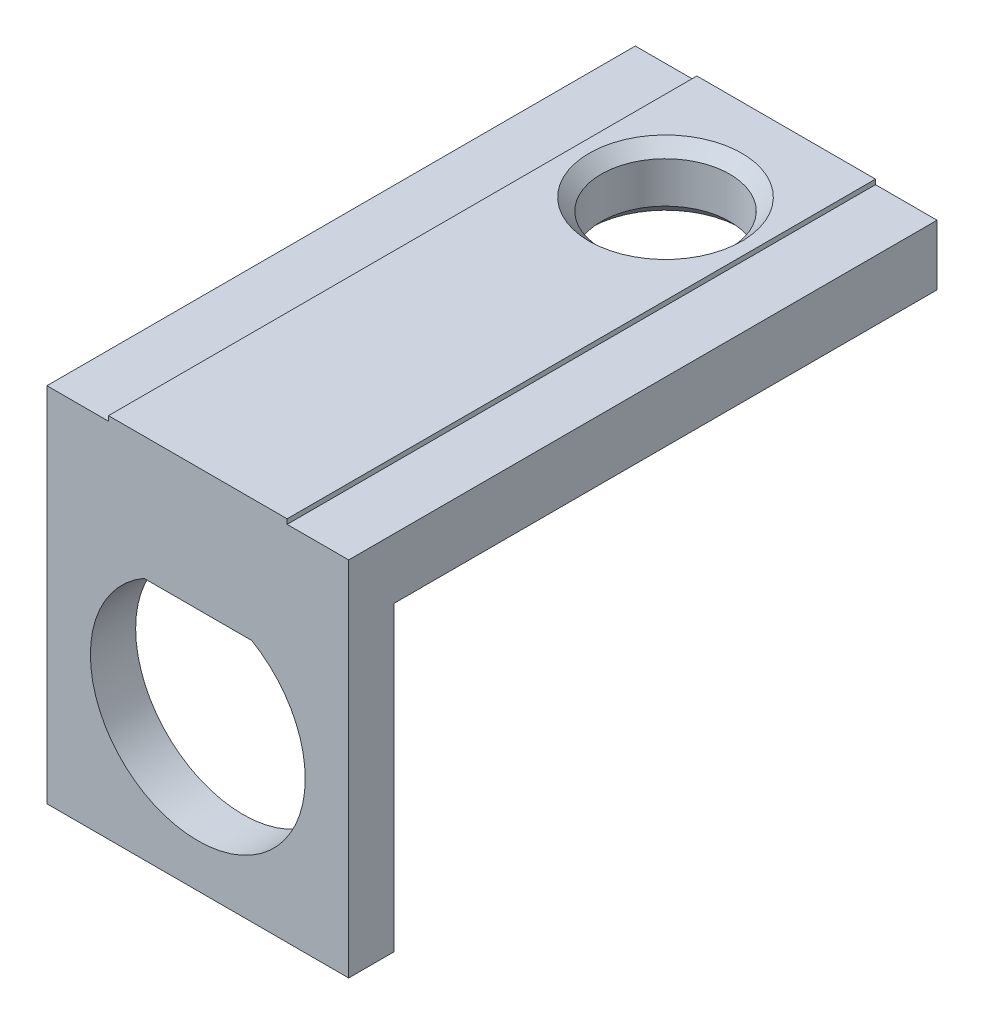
SolidWorks part; units mm, degrees
ref_plane "Front" through (0, 0, 0) normal (0, 0, 1) x (1, 0, 0)
ref_plane "Top" through (0, 0, 0) normal (0, 1, 0) x (1, 0, 0)
ref_plane "Right" through (0, 0, 0) normal (1, 0, 0) x (0, 0, -1)
sketch "Sketch1" plane through (0, 0, 0) normal (0, 0, 1) x (1, 0, 0)
  line L0 (-7.9375, -5.6515) -> (7.9375, -5.6515) construction
  line L1 (-7.9375, 11.1125) -> (7.9375, 11.1125)
  line L2 (-7.9375, 11.1125) -> (-7.9375, -11.1125)
  line L3 (-7.9375, -11.1125) -> (7.9375, -11.1125)
  line L4 (7.9375, 11.1125) -> (7.9375, -11.1125)
  line L5 (-7.9375, 11.1125) -> (7.9375, -11.1125) construction
  line L6 (-7.9375, -11.1125) -> (7.9375, 11.1125) construction
  line L7 (-7.9375, 4.8895) -> (7.9375, 4.8895) construction
  line L8 (-2.8341, 4.8895) -> (2.8341, 4.8895)
  arc A0 (-2.8341, 4.8895) -> (2.8341, 4.8895) centre (0, 0) ccw
  point P0 (0, 0)
  dimension "D3" = 11.303
  dimension "D1" = 15.875
  dimension "D2" = 22.225
  dimension "D4" = 10.541
extrude "Boss-Extrude1" add sketch "Sketch1" along normal blind 2.3813
sketch "Sketch2" plane through (0, 0, 0) normal (0, 0, -1) x (-1, 0, 0)
  line L0 (7.9375, 11.1125) -> (7.9375, -11.1125) construction
  line L1 (-7.9375, 11.1125) -> (7.9375, 11.1125)
  line L2 (-7.9375, 11.1125) -> (-7.9375, 7.9375)
  line L3 (-7.9375, 7.9375) -> (7.9375, 7.9375)
  line L4 (7.9375, 11.1125) -> (7.9375, 7.9375)
  line L5 (-11.1799, 0) -> (14.4512, 0) construction
  dimension "D1" = 3.175
extrude "Boss-Extrude2" add sketch "Sketch2" along normal blind 28.575
sketch "Sketch12" plane through (0, 0, 0) normal (0, 0, -1) x (-1, 0, 0)
  line L0 (7.9375, 7.9375) -> (7.9375, -11.1125) construction
  line L1 (-7.9375, -11.1125) -> (7.9375, -11.1125)
  line L2 (-7.9375, -11.1125) -> (-7.9375, -7.9375)
  line L3 (-7.9375, -7.9375) -> (7.9375, -7.9375)
  line L4 (7.9375, -11.1125) -> (7.9375, -7.9375)
  dimension "D1" = 3.175
extrude "Cut-Extrude1" cut sketch "Sketch12" against normal through all
sketch "Sketch15" plane through (0, 11.1125, 0) normal (0, 1, 0) x (1, 0, 0)
  line L0 (-7.9375, 28.575) -> (7.9375, 28.575) construction
  line L1 (-4.699, 28.575) -> (4.699, 28.575)
  line L2 (-4.699, 28.575) -> (-4.699, -2.3813)
  line L3 (-4.699, -2.3813) -> (4.699, -2.3813)
  line L4 (4.699, 28.575) -> (4.699, -2.3813)
  line L5 (7.9375, -2.3813) -> (-7.9375, -2.3813) construction
  dimension "D1" = 9.398
  dimension "D2" = 4.699
extrude "Boss-Extrude7" add sketch "Sketch15" along normal blind 0.254
hole_wizard "1/4-20 Tapped Hole2" positions "Sketch14" profile "Sketch13" tap size "1/4-20" standard "Ansi Inch"
sketch "Sketch14" plane through (0.0517, 11.3665, -1.1921) normal (0, 1, 0) x (-1, 0, 0)
  line L0 (7.9892, -27.3829) -> (4.7507, -27.3829) construction
  point P0 (0.0517, -21.0329)
  dimension "D1" = 6.35
sketch "Sketch13" plane through (0, 11.3665, -22.225) normal (1, 0, 0) x (0, 0, 1)
  line L0 (0, 0) -> (0, 19.304)
  line L1 (0, 19.304) -> (2.5527, 19.304)
  line L2 (2.5527, 19.304) -> (2.5527, 0)
  line L5 (2.5527, 0) -> (0, 0)
  line L11 (0, -6.35) -> (0, 107.95) construction
  dimension "Thru Tap Drill Dia." = 5.1054
  dimension "Thru Tap Drill Depth" = 19.304
hole_wizard "1/4 Clearance Hole1" positions "Sketch16" profile "Sketch18" hole size "1/4" standard "ANSI Inch"
sketch "Sketch16" plane through (0, 11.3665, 0) normal (0, 1, 0) x (1, 0, 0)
  point P0 (0, 22.225)
sketch "Sketch18" plane through (0, 11.3665, -22.225) normal (1, 0, 0) x (0, 0, 1)
  line L0 (0, 0) -> (0, 3.429)
  line L1 (0, 3.429) -> (4.0132, 3.429)
  line L2 (3.3782, 2.794) -> (3.3782, 0.635)
  line L3 (3.3782, 0.635) -> (4.0132, 0)
  line L5 (4.0132, 0) -> (0, 0)
  line L6 (-3.3782, 0.635) -> (-4.0132, 0) construction
  line L7 (4.0132, 3.429) -> (3.3782, 2.794)
  line L8 (-4.0132, 3.429) -> (-3.3782, 2.794) construction
  line L11 (0, -6.35) -> (0, 107.95) construction
  dimension "Thru Hole Dia." = 6.7564
  dimension "Thru Hole Depth" = 3.429
  dimension "Near C'Sink Dia." = 8.0264
  dimension "Near C'Sink Angle" = 90
  dimension "Far C'Sink Dia." = 8.0264
  dimension "Far C'Sink Angle" = 90
